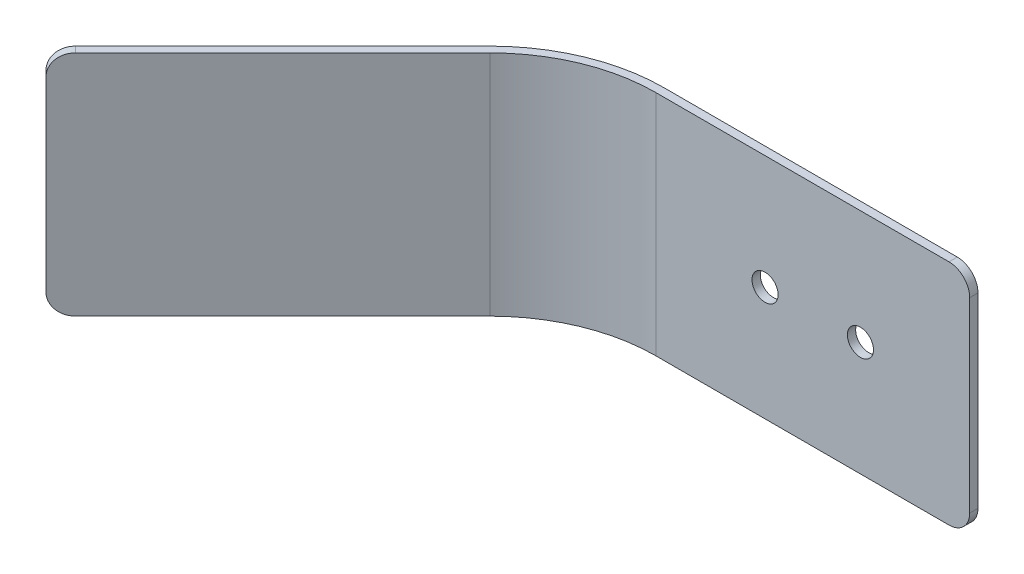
SolidWorks part; units mm, degrees
ref_plane "Front Plane" through (0, 0, 0) normal (0, 0, 1) x (1, 0, 0)
ref_plane "Top Plane" through (0, 0, 0) normal (0, 1, 0) x (1, 0, 0)
ref_plane "Right Plane" through (0, 0, 0) normal (1, 0, 0) x (0, 0, -1)
sketch "Sketch1" plane through (0, 0, 0) normal (0, 0, 1) x (1, 0, 0)
  line L1 (0, 0) -> (118.2687, 0)
  line L2 (0, 0) -> (0, 69.85)
  line L3 (0, 69.85) -> (118.2687, 69.85)
  line L4 (118.2687, 0) -> (118.2687, 69.85)
  dimension "D1" = 69.85
  dimension "D2" = 118.2687
ref_plane "Plane1" through (0, 0, 0) normal (0.7071, 0, 0.7071) x (0.7071, 0, -0.7071)
sketch "Sketch2" plane through (0, 0, 0) normal (0.7071, 0, 0.7071) x (0.7071, 0, -0.7071)
  line L1 (0, 0) -> (-118.2687, 0)
  line L2 (0, 0) -> (0, 69.85)
  line L3 (0, 69.85) -> (-118.2687, 69.85)
  line L4 (-118.2687, 0) -> (-118.2687, 69.85)
  dimension "D1" = 118.2687
  dimension "D2" = 69.85
extrude "Boss-Extrude1" add sketch "Sketch2" along normal blind 2.54
extrude "Boss-Extrude2" add sketch "Sketch1" along normal blind 2.54
fillet "Fillet3" radius 50.8 1 edges at (1.0521, 34.925, 2.54)
sketch "Sketch3" plane through (0, 0, 0) normal (0, -1, 0) x (1, 0, 0)
  line L0 (38.8909, -38.8909) -> (-38.8909, 38.8909) construction
  line L1 (0, 0) -> (118.2687, 0) construction
  line L4 (22.0942, 0) -> (0, 0)
  line L5 (0, 0) -> (-15.6229, 15.6229)
  arc A0 (22.0942, 0) -> (-15.6229, 15.6229) centre (22.0942, 53.34) cw
  arc A5 (-13.8269, 17.419) -> (22.0942, 2.54) centre (22.0942, 53.34) ccw construction
extrude "Cut-Extrude1" cut sketch "Sketch3" against normal through all
fillet "Fillet4" radius 6.35 4 edges at (118.2687, 0, 1.27) (118.2687, 69.85, 1.27) (-82.7306, 69.85, 84.5267) (-82.7306, 0, 84.5267)
sketch "Sketch5" plane through (0, 0, 2.54) normal (0, 0, 1) x (1, 0, 0)
  line L0 (22.0942, 34.925) -> (118.2687, 34.925) construction
  line L1 (22.0942, 69.85) -> (22.0942, 0) construction
  line L2 (118.2687, 6.35) -> (118.2687, 63.5) construction
  circle A0 centre (55.5765, 34.925) radius 4
  circle A1 centre (84.7865, 34.925) radius 4
  point P10 (70.1815, 34.925)
  dimension "D1" = 8
  dimension "D2" = 8
  dimension "D3" = 29.21
  dimension "D4" = 14.605
extrude "Cut-Extrude2" cut sketch "Sketch5" against normal through all
